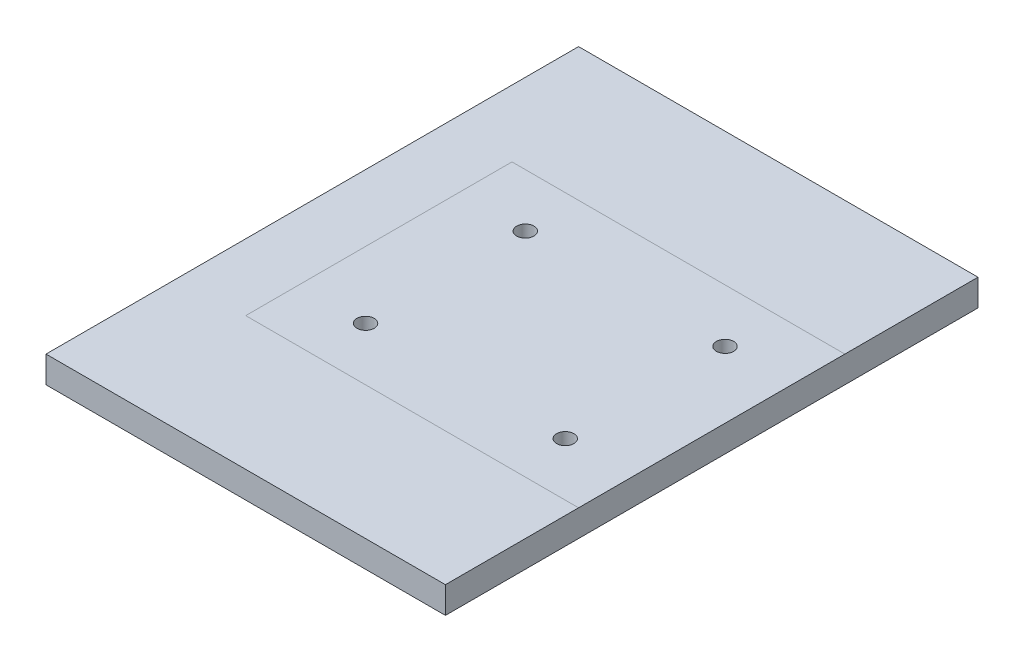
SolidWorks part; units mm, degrees
ref_plane "Front Plane" through (0, 0, 0) normal (0, 0, 1) x (1, 0, 0)
ref_plane "Top Plane" through (0, 0, 0) normal (0, 1, 0) x (1, 0, 0)
ref_plane "Right Plane" through (0, 0, 0) normal (1, 0, 0) x (0, 0, -1)
sketch "Sketch1" plane through (0, 0, 0) normal (0, 1, 0) x (1, 0, 0)
  line L1 (-150, 200) -> (150, 200)
  line L2 (-150, 200) -> (-150, -200)
  line L3 (-150, -200) -> (150, -200)
  line L4 (150, 200) -> (150, -200)
  dimension "D1" = 300
  dimension "D2" = 400
  dimension "D3" = 200
  dimension "D4" = 150
extrude "Support Plate" add sketch "Sketch1" against normal blind 20
sketch "Sketch2" plane through (0, 0, 0) normal (0, 1, 0) x (-1, 0, 0)
  line L0 (-150, 200) -> (-150, -200) construction
  circle A0 centre (-100, -60) radius 6.5
  circle A1 centre (50, -60) radius 6.5
  circle A2 centre (50, 60) radius 6.5
  circle A3 centre (-100, 60) radius 6.5
  dimension "D9" = 13
  dimension "D10" = 13
  dimension "D11" = 13
  dimension "D12" = 13
  dimension "D1" = 50
  dimension "D2" = 200
  dimension "D3" = 50
  dimension "D4" = 200
  dimension "D5" = 60
  dimension "D6" = 60
  dimension "D7" = 60
  dimension "D8" = 60
extrude "Bolt Holes" cut sketch "Sketch2" against normal through all
ref_plane "Plane1" through (0, 50, 0) normal (0, 1, 0) x (-1, 0, 0)
sketch "Sketch3" plane through (0, 50, 0) normal (0, 1, 0) x (-1, 0, 0)
  line L0 (-150, 200) -> (-150, -200) construction
  line L1 (-150, -100) -> (100, -100)
  line L2 (-150, -100) -> (-150, 100)
  line L3 (-150, 100) -> (100, 100)
  line L4 (100, -100) -> (100, 100)
  dimension "D1" = 200
  dimension "D2" = 250
  dimension "D3" = 100
ref_plane "Plane2" through (0, -70, 0) normal (0, -1, 0) x (1, 0, 0)
sketch "Sketch4" plane through (0, -70, 0) normal (0, -1, 0) x (1, 0, 0)
  circle A0 centre (-50, 60) radius 14
  dimension "D1" = 28
sketch "Sketch5" plane through (0, -70, 0) normal (0, -1, 0) x (1, 0, 0)
  circle A0 centre (100, 60) radius 14
  dimension "D1" = 28
sketch "Sketch6" plane through (0, -70, 0) normal (0, -1, 0) x (1, 0, 0)
  circle A0 centre (-50, -60) radius 14
  dimension "D1" = 28
sketch "Sketch7" plane through (0, -70, 0) normal (0, -1, 0) x (1, 0, 0)
  circle A0 centre (100, -60) radius 14
  dimension "D1" = 28
